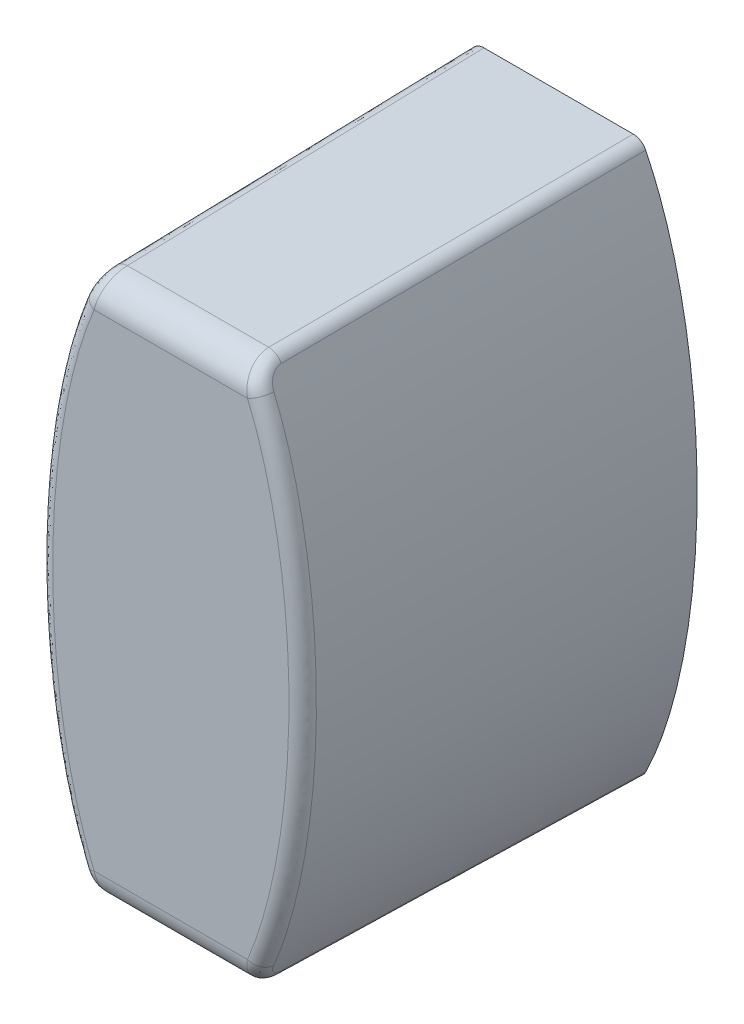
SolidWorks part; units mm, degrees
ref_plane "Plan de face" through (0, 0, 0) normal (0, 0, 1) x (1, 0, 0)
ref_plane "Plan de dessus" through (0, 0, 0) normal (0, 1, 0) x (1, 0, 0)
ref_plane "Plan de droite" through (0, 0, 0) normal (1, 0, 0) x (0, 0, -1)
sketch "Esquisse1" plane through (0, 0, 0) normal (0, 0, 1) x (1, 0, 0)
  line L0 (0, -22.6573) -> (0, 31.0102) construction
  line L1 (-3, 10) -> (3, 10)
  line L2 (-3, -10) -> (3, -10)
  ellipse E0 centre (0, 0) end of major axis (0, -12.5) minor radius 5 (3, -10) -> (3, 10) ccw
  ellipse E1 centre (0, 0) end of major axis (0, -12.5) minor radius 5 (-3, 10) -> (-3, -10) ccw
  dimension "D1" = 10
  dimension "D2" = 12.5
  dimension "D3" = 25
  dimension "D4" = 20
  dimension "D5" = 10
extrude "Extrusion1" add sketch "Esquisse1" along normal blind 14 draft 1
sketch "Esquisse2" plane through (0, 0, 0) normal (0, 0, -1) x (-1, 0, 0)
  circle A0 centre (0, 0) radius 2.5
  dimension "D1" = 5
extrude "Enlèv. mat.-Extru.1" cut sketch "Esquisse2" against normal blind 10
fillet "Congé1" radius 1 2 edges at (0, -9.7556, 14) (0, 9.7556, 14)
fillet "Congé2" radius 0.5 10 edges at (-2.9029, 9.8391, 9.2158) (-3.0128, 9.4398, 13.7452) (-2.9029, -9.8391, 9.2158) (-2.9478, -9.581, 13.5891) (2.9029, -9.8391, 9.2158) (3.0128, -9.4398, 13.7452) (2.9029, 9.8391, 9.2158) (2.9478, 9.581, 13.5891) (-4.312, 5.1255, 14) (4.312, -5.1255, 14)
sketch "Esquisse3" plane through (0, 0, 0) normal (0, 0, -1) x (-1, 0, 0)
  line L0 (-2.6948, -9) -> (2.6948, -9)
  line L1 (2.6948, 9) -> (-2.6948, 9)
  line L2 (2.6948, 10) -> (-2.6948, 10)
  line L3 (-2.6948, -10) -> (2.6948, -10)
  line L4 (2.6948, 10) -> (-2.6948, 10)
  line L5 (-2.6948, -10) -> (2.6948, -10)
  arc A4 (3.1429, 9.7218) -> (2.6948, 10) centre (2.6948, 9.5001) ccw
  arc A5 (-2.6948, 10) -> (-3.1429, 9.7218) centre (-2.6948, 9.5001) ccw
  arc A6 (-3.1429, -9.7218) -> (-2.6948, -10) centre (-2.6948, -9.5001) ccw
  arc A7 (2.6948, -10) -> (3.1429, -9.7218) centre (2.6948, -9.5001) ccw
  arc A8 (3.1429, 9.7218) -> (2.6948, 10) centre (2.6948, 9.5001) ccw
  arc A9 (-2.6948, 10) -> (-3.1429, 9.7218) centre (-2.6948, 9.5001) ccw
  arc A10 (-3.1429, -9.7218) -> (-2.6948, -10) centre (-2.6948, -9.5001) ccw
  arc A11 (2.6948, -10) -> (3.1429, -9.7218) centre (2.6948, -9.5001) ccw
  point P2 (-2.2466, 9.2783)
  point P3 (-2.2466, -9.2783)
  point P16 (2.2466, -9.2783)
  point P17 (2.2466, 9.2783)
  dimension "D1" = 0
  dimension "D2" = 1
extrude "Enlèv. mat.-Extru.2" cut sketch "Esquisse3" against normal blind 0.1
sketch "Esquisse4" plane through (0, 0, 0.1) normal (0, 0, -1) x (-1, 0, 0)
  circle A0 centre (0, 6.25) radius 1.25
  circle A1 centre (0, -6.25) radius 1.25
  dimension "D3" = 2.5
  dimension "D4" = 2.5
  dimension "D1" = 6.25
  dimension "D2" = 6.25
extrude "Enlèv. mat.-Extru.3" cut sketch "Esquisse4" against normal blind 5
